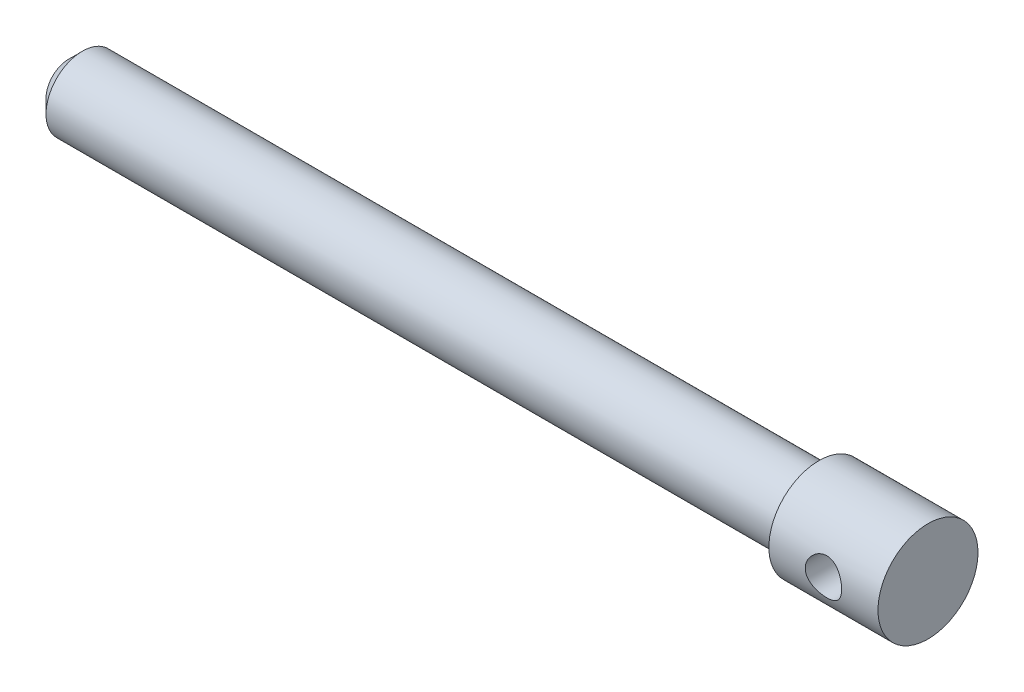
SolidWorks part; units mm, degrees
ref_plane "Front Plane" through (0, 0, 0) normal (0, 0, 1) x (1, 0, 0)
ref_plane "Top Plane" through (0, 0, 0) normal (0, 1, 0) x (1, 0, 0)
ref_plane "Right Plane" through (0, 0, 0) normal (1, 0, 0) x (0, 0, -1)
sketch "Sketch1" plane through (0, 0, 0) normal (1, 0, 0) x (0, 0, -1)
  circle A0 centre (0, 0) radius 8
  dimension "D1" = 16
extrude "Boss-Extrude1" add sketch "Sketch1" along normal mid plane 165
sketch "Sketch2" plane through (82.5, 0, 0) normal (1, 0, 0) x (0, 0, -1)
  circle A0 centre (0, 0) radius 11
  dimension "D1" = 22
extrude "Boss-Extrude2" add sketch "Sketch2" along normal blind 24
chamfer "Chamfer1" distance 3 angle 45 1 edges at (-82.5, 0, -8)
sketch "Sketch3" plane through (0, 0, 0) normal (0, 0, 1) x (1, 0, 0)
  line L0 (106.5, -11) -> (106.5, 11) construction
  circle A0 centre (94.5, 0) radius 4
  dimension "D1" = 8
  dimension "D2" = 12
extrude "Cut-Extrude1" cut sketch "Sketch3" against normal through all both and the other way through all
